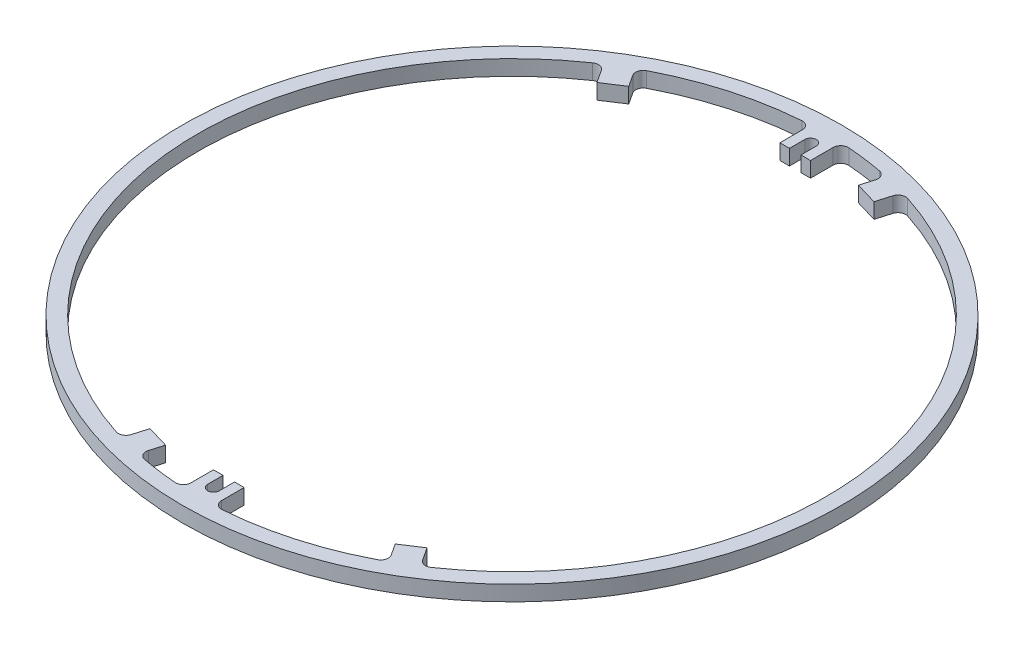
SolidWorks part; units mm, degrees
ref_plane "前视基准面" through (0, 0, 0) normal (0, 0, 1) x (1, 0, 0)
ref_plane "上视基准面" through (0, 0, 0) normal (0, 1, 0) x (1, 0, 0)
ref_plane "右视基准面" through (0, 0, 0) normal (1, 0, 0) x (0, 0, -1)
sketch "草图1" plane through (0, 0, 0) normal (0, 1, 0) x (1, 0, 0)
  circle A0 centre (0, 0) radius 43
  circle A1 centre (0, 0) radius 41
  circle A2 centre (0, 0) radius 35 construction
  dimension "D1" = 86
  dimension "D2" = 2
  dimension "D3" = 70
extrude "凸台-拉伸1" add sketch "草图1" along normal blind 2
sketch "草图2" plane through (0, 2, 0) normal (0, 1, 0) x (1, 0, 0)
  line L0 (0, 0) -> (0, 47.3857) construction
  line L1 (-2, 40.9512) -> (-2, 36.9512)
  line L2 (-2, 36.9512) -> (2, 36.9512)
  line L3 (2, 40.9512) -> (2, 36.9512)
  line L4 (0, 0) -> (51.4644, 0) construction
  line L5 (2, -40.9512) -> (2, -36.9512)
  line L6 (-2, -40.9512) -> (-2, -36.9512)
  line L7 (-2, -36.9512) -> (2, -36.9512)
  circle A0 centre (0, 0) radius 41 construction
  circle A1 centre (0, 0) radius 41
  circle A3 centre (0, 38.9512) radius 0.75
  point P10 (0, 36.9512)
  dimension "D3" = 1.5
  dimension "D4" = 2
  dimension "D1" = 4
  dimension "D2" = 4
extrude "凸台-拉伸2" add sketch "草图2" against normal up to surface (2 mm away) contours L7 L6 L5 M8 | L3 L1 L2 M8
fillet "圆角1" radius 1 2 edges at (2, 1, -40.9512) (-2, 1, -40.9512)
fillet "圆角2" radius 1 2 edges at (2, 1, 40.9512) (-2, 1, 40.9512)
sketch "草图3" plane through (0, 2, 0) normal (0, 1, 0) x (1, 0, 0)
  line L0 (-0.75, 38.9512) -> (-0.75, 35.9512)
  line L1 (-0.75, 35.9512) -> (0.75, 35.9512)
  line L2 (0.75, 35.9512) -> (0.75, 38.9512)
  line L3 (0, 0) -> (58.5732, 0) construction
  line L4 (0.75, -35.9512) -> (0.75, -38.9512)
  line L5 (-0.75, -35.9512) -> (0.75, -35.9512)
  line L6 (-0.75, -38.9512) -> (-0.75, -35.9512)
  arc A0 (0.75, 38.9512) -> (-0.75, 38.9512) centre (0, 38.9512) ccw
  arc A1 (0.75, -38.9512) -> (-0.75, -38.9512) centre (0, -38.9512) cw
  dimension "D2" = 0.75
  dimension "D1" = 3
extrude "切除-拉伸1" cut sketch "草图3" against normal through all
sketch "草图4" plane through (0, 2, 0) normal (0, 1, 0) x (1, 0, 0)
  line L0 (0, 0) -> (-13.5707, -45.8138) construction
  line L1 (-11.6446, -39.3116) -> (-10.7926, -36.4351)
  line L2 (-10.7926, -36.4351) -> (-7.9161, -37.2872)
  line L3 (-7.9161, -37.2872) -> (-8.737, -40.0583)
  line L4 (0, 0) -> (53.3121, -15.7918) construction
  line L8 (0, 0) -> (0, -55.1104) construction
  line L9 (11.6446, 39.3116) -> (10.7926, 36.4351)
  line L10 (10.7926, 36.4351) -> (7.9161, 37.2872)
  line L11 (7.9161, 37.2872) -> (8.737, 40.0583)
  arc A0 (-3.075, 40.8845) -> (-3.075, -40.8845) centre (0, 0) ccw construction
  arc A1 (-11.6446, -39.3116) -> (-8.737, -40.0583) centre (0, 0) ccw
  arc A2 (11.6446, 39.3116) -> (8.737, 40.0583) centre (0, 0) ccw
  point P19 (0, 0)
  dimension "D1" = 3
  dimension "D2" = 3
  dimension "D3" = 16.5
  dimension "D4" = 2
extrude "凸台-拉伸3" add sketch "草图4" against normal up to surface (2 mm away)
fillet "圆角4" radius 1 2 edges at (-8.737, 1, 40.0583) (-11.6446, 1, 39.3116)
fillet "圆角6" radius 1 2 edges at (11.6446, 1, -39.3116) (8.737, 1, -40.0583)
sketch "草图5" plane through (0, 0, 0) normal (0, -1, 0) x (1, 0, 0)
  line L0 (-11.3571, 38.3408) -> (-10.7926, 36.4351) construction
  line L1 (-11.3571, 38.3408) -> (0, 0) construction
  line L2 (0, 0) -> (26.8882, 41.2463) construction
  line L3 (22.3902, 34.3465) -> (20.7519, 31.8333)
  line L4 (20.7519, 31.8333) -> (18.2387, 33.4716)
  line L5 (18.2387, 33.4716) -> (19.817, 35.8927)
  line L6 (-18.2387, -33.4716) -> (-19.817, -35.8927)
  line L7 (-20.7519, -31.8333) -> (-18.2387, -33.4716)
  line L8 (-22.3902, -34.3465) -> (-20.7519, -31.8333)
  arc A0 (12.6238, -39.0082) -> (3.075, 40.8845) centre (0, 0) ccw construction
  arc A1 (22.3902, 34.3465) -> (19.817, 35.8927) centre (0, 0) ccw
  arc A2 (-22.3902, -34.3465) -> (-19.817, -35.8927) centre (0, 0) ccw
  point P18 (0, 0)
  dimension "D1" = 49.6
  dimension "D2" = 3
  dimension "D3" = 3
  dimension "D4" = 2
extrude "凸台-拉伸4" add sketch "草图5" against normal up to surface (2 mm away)
fillet "圆角7" radius 1 4 edges at (-22.3902, 1, -34.3465) (-19.817, 1, -35.8927) (22.3902, 1, 34.3465) (19.817, 1, 35.8927)
